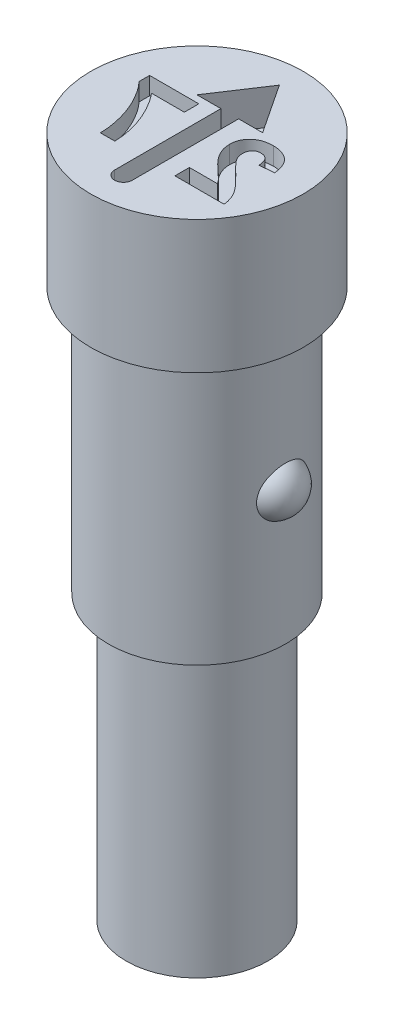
SolidWorks part; units mm, degrees
ref_plane "Front Plane" through (0, 0, 0) normal (0, 0, 1) x (1, 0, 0)
ref_plane "Top Plane" through (0, 0, 0) normal (0, 1, 0) x (1, 0, 0)
ref_plane "Right Plane" through (0, 0, 0) normal (1, 0, 0) x (0, 0, -1)
sketch "Sketch1" plane through (0, 0, 0) normal (0, 0, 1) x (1, 0, 0)
  line L0 (0, 0) -> (0, -7.7) construction
  line L1 (0, -1.32) -> (0, 1.32) construction
  line L2 (0, 0) -> (-1.2, 0)
  line L3 (-1.2, 0) -> (-1.2, -1.5)
  line L4 (-1.2, -1.5) -> (-1, -1.5)
  line L5 (-1, -1.5) -> (-1, -4.5)
  line L6 (-1, -4.5) -> (-0.8, -4.5)
  line L7 (-0.8, -4.5) -> (-0.8, -7.7)
  line L8 (-0.8, -7.7) -> (0, -7.7)
  line L9 (0, -7.7) -> (0, 0)
  dimension "D1" = 2.4
  dimension "D2" = 7.7
  dimension "D3" = 1.5
  dimension "D4" = 4.5
  dimension "D5" = 2
  dimension "D6" = 1.6
revolve "Revolve1" add sketch "Sketch1" angle 360 about L0
sketch "Sketch3" plane through (0, 0, 0) normal (0, 1, 0) x (1, 0, 0)
  line L0 (0, 0.93) -> (-0.3707, 0.37)
  line L1 (-0.3707, 0.37) -> (-0.1, 0.37)
  line L2 (-0.1, 0.37) -> (-0.1, -0.83)
  line L3 (0.1, -0.83) -> (0.1, 0.37)
  line L4 (0.1, 0.37) -> (0.3707, 0.37)
  line L5 (0.3707, 0.37) -> (0, 0.93)
  line L6 (0, 0.93) -> (0, -0.93) construction
  arc A0 (-0.1, -0.83) -> (0.1, -0.83) centre (0, -0.83) ccw
  dimension "D3" = 0.1
  dimension "D1" = 0.56
  dimension "D2" = 67
  dimension "D4" = 1.76
extrude "Cut-Extrude1" cut sketch "Sketch3" against normal blind 0.4
sketch "Sketch4" plane through (0, 0, 0) normal (0, 1, 0) x (1, 0, 0)
  text T0 "27" font "Arial" height 0.85
extrude "Cut-Extrude2" cut sketch "Sketch4" against normal blind 0.2
sketch "Sketch5" plane through (0, 0, 0) normal (0, 0, 1) x (1, 0, 0)
  line L2 (0.8679, -2.7) -> (0.8679, -3.3)
  line L3 (0.8679, -2.7) -> (0.8679, -3.3) construction
  line L4 (-1, -3) -> (0.8679, -3) construction
  line L5 (-1, -1.5) -> (-1, -4.5) construction
  arc A1 (0.8679, -3.3) -> (0.8679, -2.7) centre (0.8679, -3) ccw
  dimension "D1" = 0.3
revolve "Revolve2" add sketch "Sketch5" angle 360 about L2
